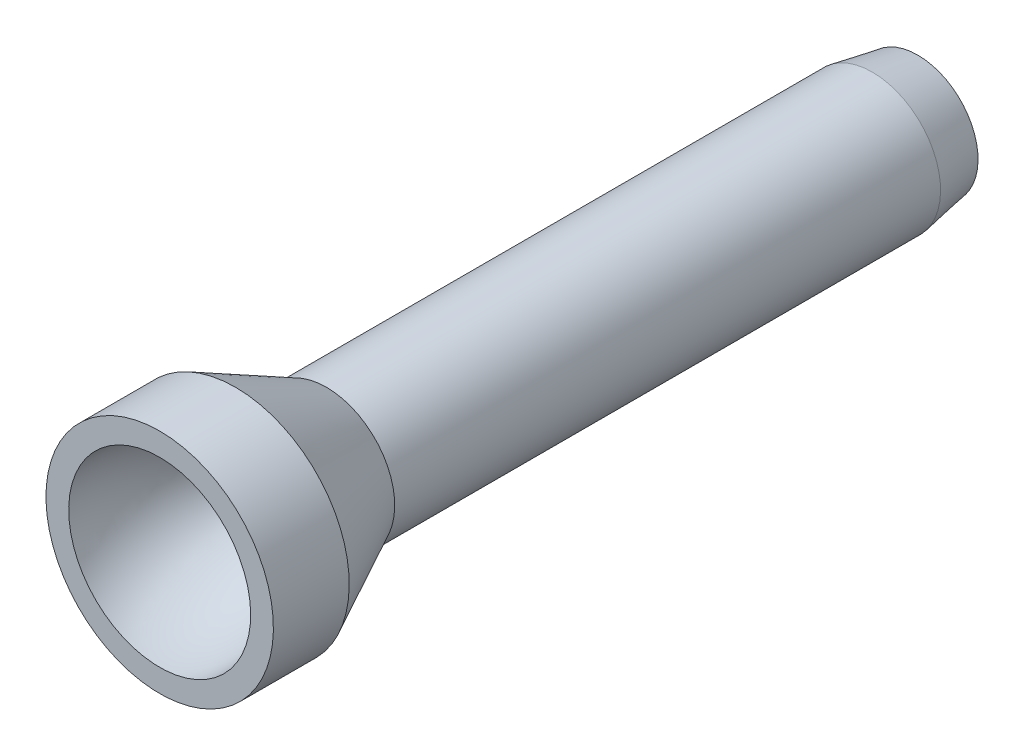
SolidWorks part; units mm, degrees
ref_plane "Front" through (0, 0, 0) normal (0, 0, 1) x (1, 0, 0)
ref_plane "Top" through (0, 0, 0) normal (0, 1, 0) x (1, 0, 0)
ref_plane "Right" through (0, 0, 0) normal (1, 0, 0) x (0, 0, -1)
sketch "Sketch1"
  dimension "D1" = 19.05
  dimension "D2" = 12.7
  dimension "D3" = 3.81
  dimension "D4" = 11.43
  dimension "D5" = 15.24
  dimension "D6" = 101.6
  dimension "D7" = 127
revolve "Revolve1" add sketch "Sketch1" angle 360 about L7
chamfer "Chamfer1" distance 7.62 angle 10 1 edges at (0, 11.43, -127)
